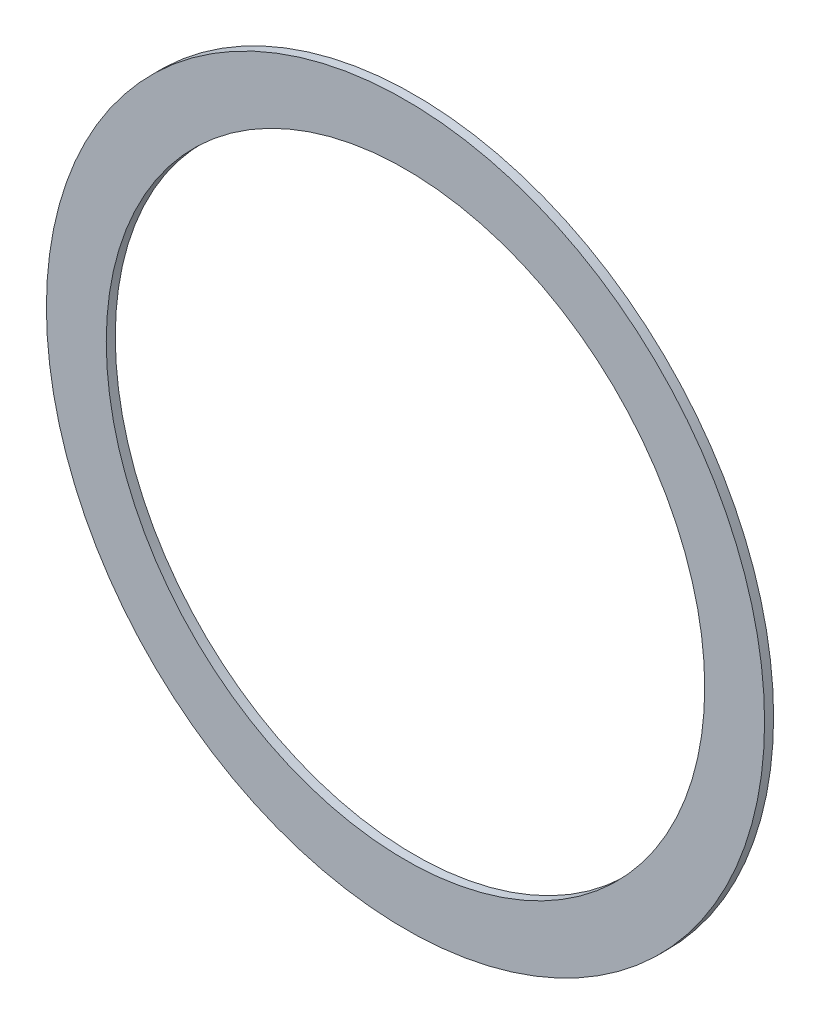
SolidWorks part; units mm, degrees
ref_plane "Front" through (0, 0, 0) normal (0, 0, 1) x (1, 0, 0)
ref_plane "Top" through (0, 0, 0) normal (0, 1, 0) x (1, 0, 0)
ref_plane "Right" through (0, 0, 0) normal (1, 0, 0) x (0, 0, -1)
sketch "Sketch1" plane through (0, 0, 0) normal (0, 0, 1) x (1, 0, 0)
  circle A0 centre (0, 0) radius 10.541
  circle A1 centre (0, 0) radius 12.6492
  dimension "D1" = 25.2984
  dimension "D2" = 21.082
extrude "Extrude1" add sketch "Sketch1" along normal blind 0.3175
